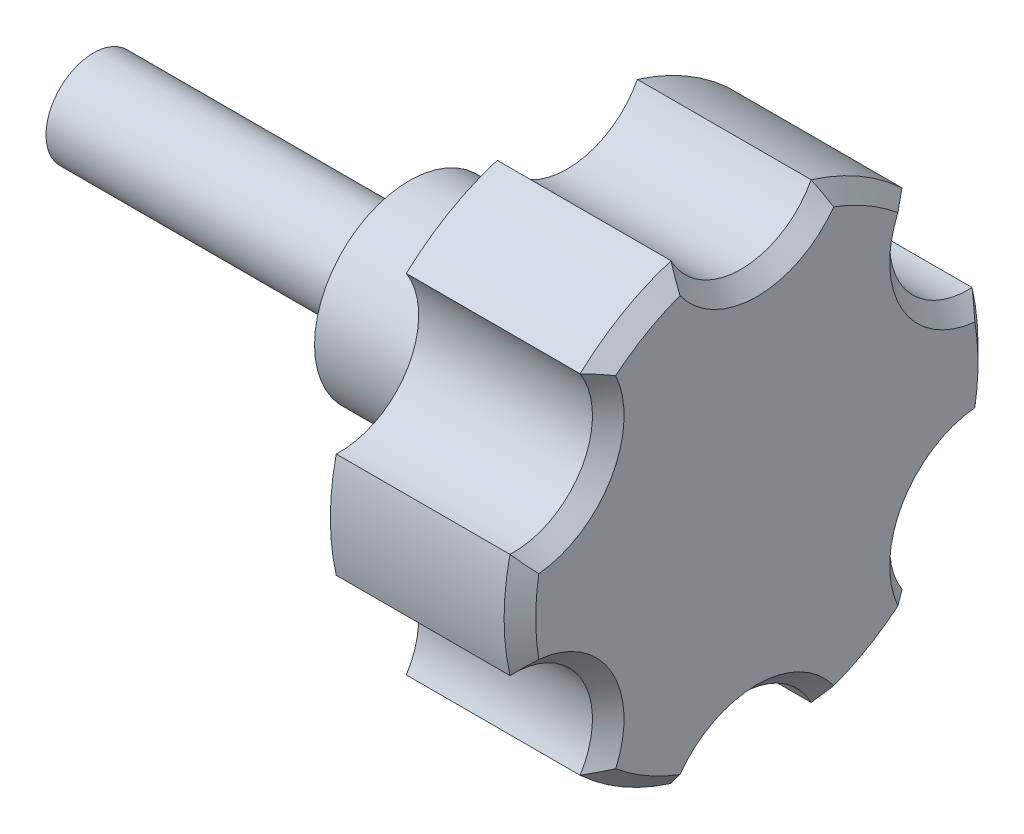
SolidWorks part; units mm, degrees
ref_plane "Face" through (0, 0, 0) normal (0, 0, 1) x (1, 0, 0)
ref_plane "Dessus" through (0, 0, 0) normal (0, 1, 0) x (1, 0, 0)
ref_plane "Droite" through (0, 0, 0) normal (1, 0, 0) x (0, 0, -1)
sketch "Esquisse1" plane through (0, 0, 0) normal (0, 0, 1) x (1, 0, 0)
  line L0 (0, 0) -> (0, 3)
  line L1 (0, 3) -> (20, 3)
  line L2 (20, 3) -> (20, 6)
  line L3 (20, 6) -> (30, 6)
  line L4 (30, 6) -> (30, 15)
  line L5 (30, 15) -> (42, 15)
  line L6 (42, 15) -> (42, 0)
  line L7 (-15.9389, 0) -> (112.3226, 0) construction
  line L8 (0, 0) -> (42, 0)
  dimension "D1" = 6
  dimension "D2" = 12
  dimension "D3" = 30
  dimension "D4" = 20
  dimension "D5" = 10
  dimension "D6" = 12
revolve "Révolution1" add sketch "Esquisse1" angle 360 about L7
sketch "Esquisse2" plane through (42, 0, 0) normal (1, 0, 0) x (0, 0, -1)
  line L0 (-4.9529, 15.9506) -> (4.9529, 15.9506)
  arc A0 (-4.9529, 15.9506) -> (4.9529, 15.9506) centre (0, 16.6354) ccw
  dimension "D2" = 5
  dimension "D1" = 16.6354
  dimension "D3" = 9.9058
extrude "Enlèv. mat.-Extru.1" cut sketch "Esquisse2" against normal through all
pattern_circular "Répétition circulaire1" count 6 every 60 about axis through (-15.9389, 0, 0) along (1, 0, 0)
chamfer "Chanfrein1" distance 1 angle 45
